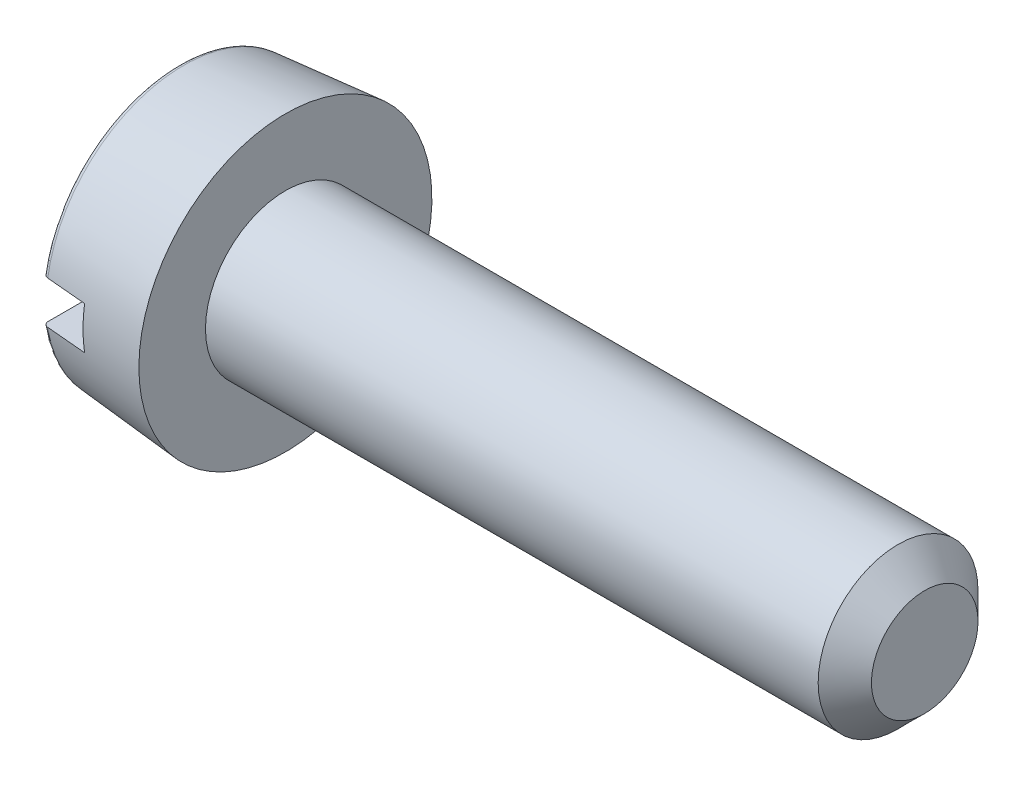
SolidWorks part; units mm, degrees
ref_plane "Plane1" through (0, 0, 0) normal (0, 0, 1) x (1, 0, 0)
ref_plane "Plane2" through (0, 0, 0) normal (0, 1, 0) x (1, 0, 0)
ref_plane "Plane3" through (0, 0, 0) normal (1, 0, 0) x (0, 0, -1)
revolve "Base-Revolve" add sketch "BodySke"
sketch "BodySke" plane through (0, 0, 0) normal (0, 0, 1) x (1, 0, 0)
  line L0 (2, 1.5) -> (2, 2.75)
  line L1 (0, 0) -> (0, 2.575)
  line L2 (-25.4, 0) -> (127, 0) construction
  line L3 (14, 0) -> (0, 0)
  line L4 (2, 1.5) -> (14, 1.5)
  line L5 (14, 1.5) -> (14, 0)
  line L6 (0, 2.575) -> (2, 2.75)
  line L9 (2.5, 3.0875) -> (2.5, -6.4375) construction
  line L10 (2, 6.35) -> (2, -3.175) construction
  dimension "Head_ht" = 2
  dimension "Diameter" = 3
  dimension "Length" = 12
  dimension "Head_dia" = 5.5
  dimension "Advance" = 0.5
  dimension "Thread_nom" = 12
  dimension "Head_side_angle" = 5
fillet "Fillet1" [suppressed] radius 0.1
fillet "Fillet2" radius 0.1
sketch "Sketch2" plane through (0, 0, 0) normal (1, 0, 0) x (0, 0, -1)
  line L0 (2.75, -0.4) -> (-2.75, -0.4)
  line L1 (2.75, -0.4) -> (2.75, 0.4)
  line L2 (-2.75, 0.4) -> (2.75, 0.4)
  line L3 (-2.75, 0.4) -> (-2.75, -0.4)
  dimension "D1" = 5.5
  dimension "D2" = 2.75
  dimension "Slot_width" = 0.8
  dimension "D3" = 0.4
extrude "Slot" cut sketch "Sketch2" along normal blind 0.85
sketch "ThdSchSke" plane through (0, 0, 0) normal (0, 0, 1) x (1, 0, 0)
  line L0 (3, -1.2195) -> (2.8036, -1.5)
  line L1 (3, -1.2195) -> (3.1964, -1.5)
  line L2 (3.1964, -1.5) -> (3.1964, -1.875)
  line L3 (-3.175, 0) -> (5.1513, 0) construction
  line L5 (3.1964, -1.875) -> (2.8036, -1.875)
  line L6 (2.8036, -1.875) -> (2.8036, -1.5)
  dimension "Thread_minor" = 2.439
  dimension "Diameter" = 3
  dimension "Start" = 3
  dimension "SideAngle" = 55
  dimension "VeeAngle" = 70
  dimension "Overcut" = 3.75
revolve "ThreadSchematic" [suppressed] cut sketch "ThdSchSke" angle 360 about L3
pattern_linear "ThdSchPat" [suppressed]
chamfer "Chanfrein1" distance 0.5 angle 45
equation "\"D1@Sketch2\" = \"Head_dia@BodySke\""
equation "\"D2@Sketch2\" = \"D1@Sketch2\" / 2"
equation "\"D3@Sketch2\" = \"Slot_width@Sketch2\" / 2"
equation "\"Thread_length@ThreadCosmetic\" = ((sgn( (\"Length@BodySke\" - \"Advance@BodySke\" * 2.0 ) - \"Thread_nom@BodySke\" )-1)*( (\"Length@BodySke\" - \"Advance@BodySke\"  * 2.0) - \"Thread_nom@BodySke\" ))/-2+ \"Thread_"
equation "\"Thread_minor@ThdSchSke\" = \"Thread_minor@ThreadCosmetic\""
equation "\"Diameter@ThdSchSke\" = \"Diameter@BodySke\""
equation "\"Overcut@ThdSchSke\" = \"Diameter@BodySke\" * 1.25"
equation "\"Start@ThdSchSke\" = \"Head_ht@BodySke\" + \"Length@BodySke\" - \"Thread_length@ThreadCosmetic\"  '---Non-countersunk---"
equation "\"Num_threads@ThdSchPat\" = int( \"Thread_length@ThreadCosmetic\" / \"Advance@BodySke\" + 0.999 )  + 1"
equation "\"Advance@ThdSchPat\" = \"Thread_length@ThreadCosmetic\" /  (\"Num_threads@ThdSchPat\" - 1) 'relax it"
